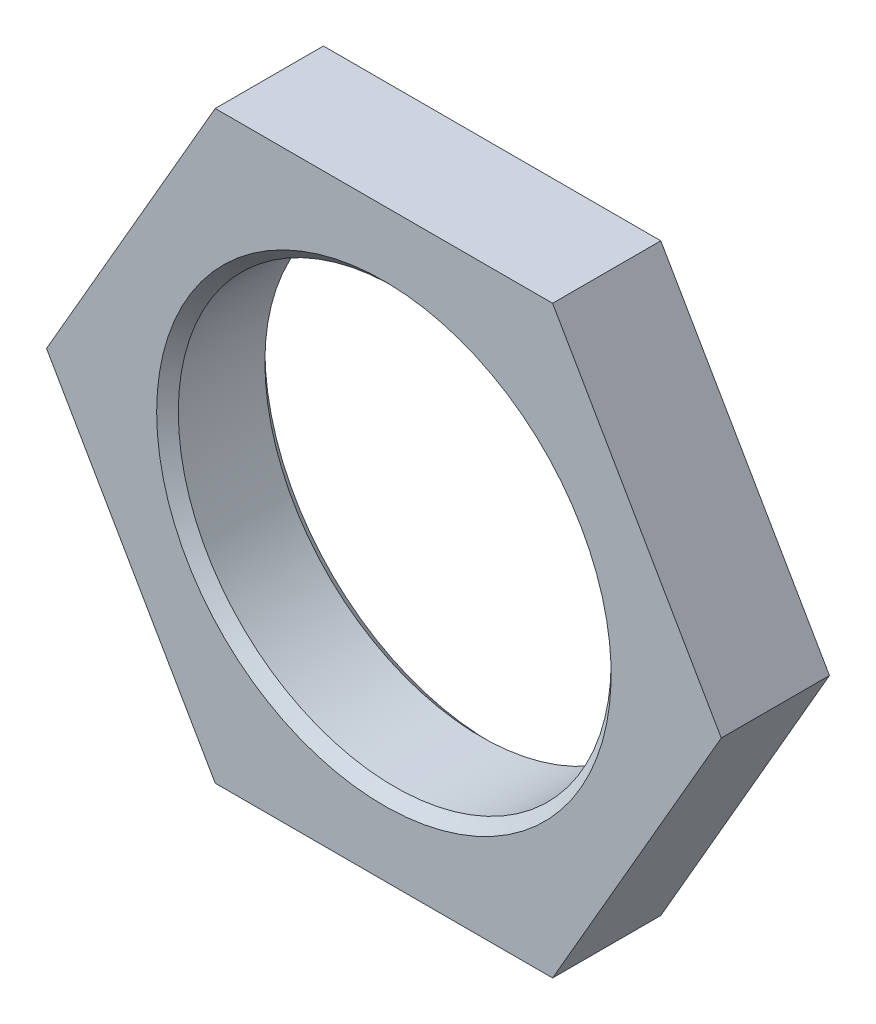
SolidWorks part; units mm, degrees
ref_plane "Plan1" through (0, 0, 0) normal (0, 0, 1) x (1, 0, 0)
ref_plane "Plan2" through (0, 0, 0) normal (0, 1, 0) x (1, 0, 0)
ref_plane "Plan3" through (0, 0, 0) normal (1, 0, 0) x (0, 0, -1)
sketch "Esquisse1" plane through (0, 0, 0) normal (0, 0, 1) x (1, 0, 0)
  line L0 (-20, 0) -> (3.1177, 0) construction
  line L1 (0, 8.564) -> (0, -21.436) construction
  line L2 (-1.5588, 2.7) -> (1.5588, 2.7)
  line L3 (-1.5588, -2.7) -> (1.5588, -2.7)
  line L4 (3.1177, 0) -> (1.5588, -2.7)
  line L5 (3.1177, 0) -> (1.5588, 2.7)
  line L6 (-3.1177, 0) -> (-1.5588, 2.7)
  line L7 (-3.1177, 0) -> (-1.5588, -2.7)
  dimension "D1" = 2.7
  dimension "D2" = 60
  dimension "D3" = 2.7
extrude "Base-Extrusion" add sketch "Esquisse1" along normal blind 1
sketch "Esquisse2" plane through (0, 0, 1) normal (0, 0, 1) x (1, 0, 0)
  circle A0 centre (0, 0) radius 2
  dimension "D1" = 4
extrude "Enlèv. mat.-Extru.1" cut sketch "Esquisse2" against normal through all
chamfer "Chanfrein1" distance 0.1 angle 45 2 edges at (2, 0, 0) (2, 0, 1)
ref_plane "Plan9" through (0, 0, 1.15) normal (0, 0, 1) x (1, 0, 0)
